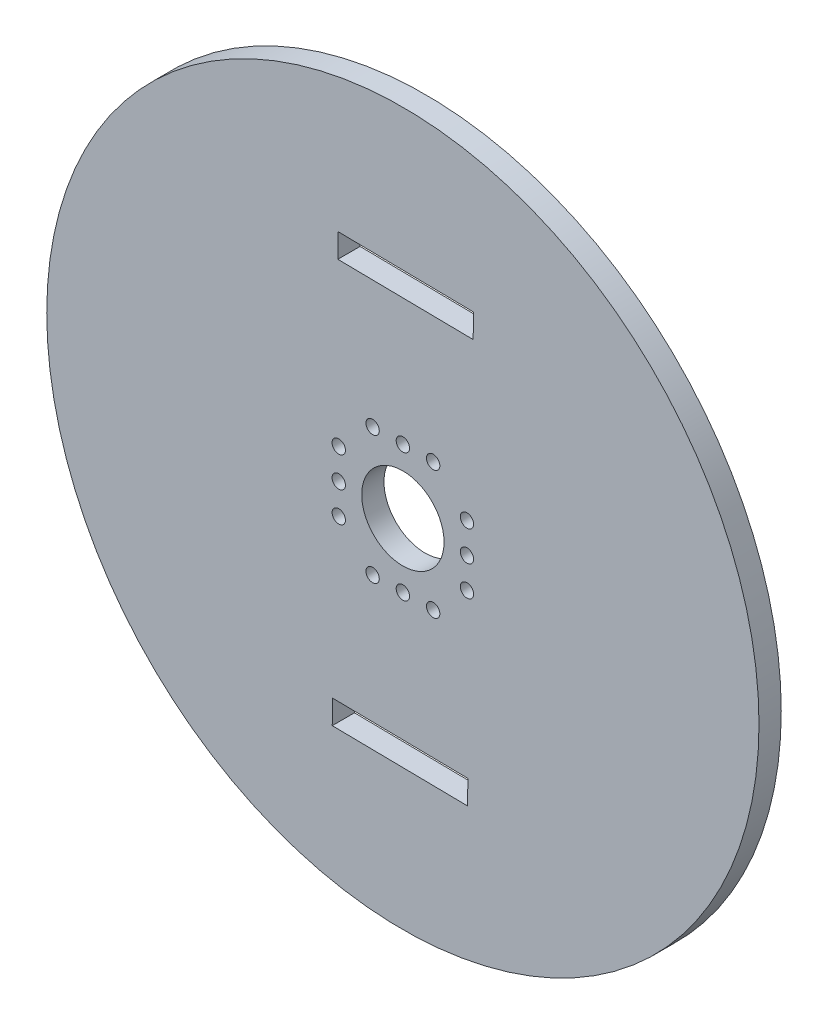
SolidWorks part; units mm, degrees
ref_plane "Front Plane" through (0, 0, 0) normal (0, 0, 1) x (1, 0, 0)
ref_plane "Top Plane" through (0, 0, 0) normal (0, 1, 0) x (1, 0, 0)
ref_plane "Right Plane" through (0, 0, 0) normal (1, 0, 0) x (0, 0, -1)
sketch "Sketch1" plane through (0, 0, 0) normal (0, 0, 1) x (1, 0, 0)
  circle A0 centre (7.2, -3.4) radius 0.75 construction
  circle A1 centre (0, 0) radius 10.4
  circle A2 centre (0, 0) radius 10.4
  circle A3 centre (7.2, 3.4) radius 0.75 construction
  circle A4 centre (7.2, 0) radius 0.75 construction
  circle A5 centre (3.4, -7.2) radius 0.75 construction
  circle A6 centre (-3.4, -7.2) radius 0.75 construction
  circle A7 centre (0, -7.2) radius 0.75 construction
  circle A8 centre (0, 0) radius 4.625 construction
  circle A9 centre (3.4, 7.2) radius 0.75 construction
  circle A10 centre (0, 7.2) radius 0.75 construction
  circle A11 centre (-3.4, 7.2) radius 0.75 construction
  circle A12 centre (-7.2, 3.4) radius 0.75 construction
  circle A13 centre (-7.2, 0) radius 0.75 construction
  circle A14 centre (-7.2, -3.4) radius 0.75 construction
  circle A15 centre (0, 0) radius 4.625
  circle A16 centre (3.4, 7.2) radius 0.75
  circle A17 centre (0, 7.2) radius 0.75
  circle A18 centre (-3.4, 7.2) radius 0.75
  circle A19 centre (-7.2, 3.4) radius 0.75
  circle A20 centre (-7.2, 0) radius 0.75
  circle A21 centre (-7.2, -3.4) radius 0.75
  circle A22 centre (0, -7.2) radius 0.75
  circle A23 centre (-3.4, -7.2) radius 0.75
  circle A24 centre (3.4, -7.2) radius 0.75
  circle A25 centre (7.2, 0) radius 0.75
  circle A26 centre (7.2, 3.4) radius 0.75
  circle A27 centre (7.2, -3.4) radius 0.75
  circle A28 centre (0, 0) radius 40
  dimension "D1" = 0
extrude "Boss-Extrude1" add sketch "Sketch1" along normal blind 2.5 contours A28 A2 | A2 A27 A26 A25 A24 A23 A22 A21 A20 A19 A18 A17 A16 A15
sketch "Sketch3" plane through (0, 0, 0) normal (0, 0, -1) x (-1, 0, 0)
  line L16 (-7.3016, -21.634) -> (7.8969, -21.4239)
  line L17 (7.9343, -24.1236) -> (7.8969, -21.4239)
  line L18 (-7.2643, -24.3338) -> (7.9343, -24.1236)
  line L19 (-7.2643, -24.3338) -> (-7.3016, -21.634)
  line L20 (7.2654, 24.255) -> (-7.9332, 24.0448)
  line L21 (-7.9332, 24.0448) -> (-7.8958, 21.3451)
  line L22 (-7.8958, 21.3451) -> (7.3027, 21.5552)
  line L23 (7.3027, 21.5552) -> (7.2654, 24.255)
extrude "Cut-Extrude1" cut sketch "Sketch3" against normal blind 10
